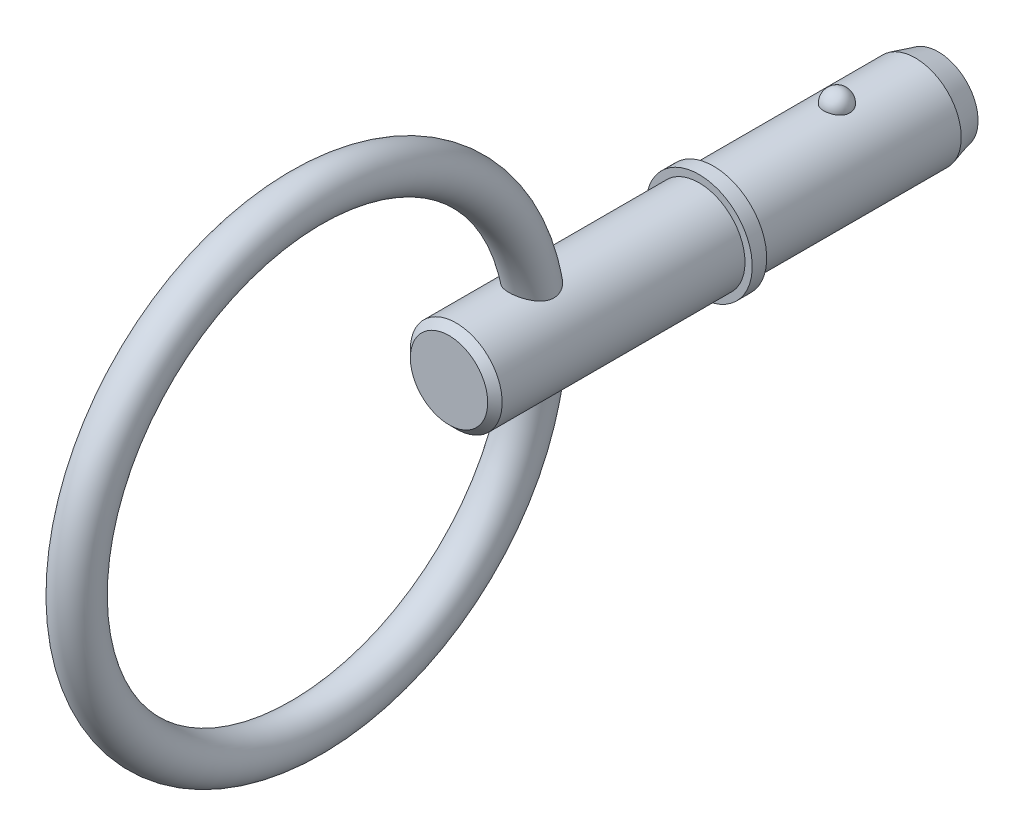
SolidWorks part; units mm, degrees
ref_plane "Front Plane" through (0, 0, 0) normal (0, 0, 1) x (1, 0, 0)
ref_plane "Top Plane" through (0, 0, 0) normal (0, 1, 0) x (1, 0, 0)
ref_plane "Right Plane" through (0, 0, 0) normal (1, 0, 0) x (0, 0, -1)
sketch "Sketch2" plane through (0, 0, 0) normal (0, 0, 1) x (1, 0, 0)
  circle A0 centre (0, 0) radius 3.175
  point P3 (0, 3.175)
  dimension "D1" = 6.35
extrude "Boss-Extrude1" add sketch "Sketch2" along normal blind 7.62
sketch "Sketch3" plane through (0, 0, 0) normal (0, 0, -1) x (-1, 0, 0)
  circle A0 centre (0, 0) radius 3.175
  dimension "D1" = 6.35
extrude "Boss-Extrude2" add sketch "Sketch3" along normal blind 7.92
chamfer "Chamfer1" distance 1.586 angle 15 1 edges at (-3.175, 0, -7.92)
sketch "Sketch18" plane through (0, 0, 0) normal (1, 0, 0) x (0, 0, -1)
  line L0 (6.334, 3.175) -> (-7.62, 3.175) construction
  line L1 (0.91, 4.085) -> (0.91, 2.265)
  line L2 (-7.62, -3.175) -> (6.334, -3.175) construction
  arc A0 (0.91, 4.085) -> (0.91, 2.265) centre (0.91, 3.175) ccw
  point P4 (0, 3.175)
  dimension "D1" = 7.26
revolve "Revolve1" add sketch "Sketch18" angle 360 about L1
sketch "Sketch19" plane through (0, 0, 0) normal (1, 0, 0) x (0, 0, -1)
  line L0 (-33.7288, 0) -> (-46.4542, 0) construction
sketch "Sketch20" plane through (0, 0, 0) normal (1, 0, 0) x (0, 0, -1)
  line L0 (-7.62, 0) -> (-7.62, 3.675)
  line L1 (-7.62, 3.175) -> (-7.62, -3.175) construction
  line L2 (-7.62, 3.675) -> (-8.62, 3.675)
  line L3 (-8.62, 3.675) -> (-8.62, 0)
  line L4 (-33.7288, 0) -> (-46.4542, 0) construction
  line L5 (-8.62, 0) -> (-7.62, 0)
  dimension "D1" = 3.675
  dimension "D2" = 1
revolve "Revolve2" add sketch "Sketch20" angle 360 about L0
sketch "Sketch21" plane through (0, 0, 7.62) normal (0, 0, -1) x (-1, 0, 0)
  circle A0 centre (0, 0) radius 3.175
  dimension "D1" = 6.35
extrude "Boss-Extrude3" add sketch "Sketch21" against normal blind 18.29
chamfer "Chamfer2" distance 0.5 angle 45 1 edges at (-3.175, 0, 25.91)
sketch "Sketch23" plane through (0, 0, 0) normal (1, 0, 0) x (0, 0, -1)
  line L0 (-25.91, 2.675) -> (-25.91, -2.675) construction
  circle A0 centre (-35.785, 0) radius 15.875
  point P2 (-19.91, 0)
  dimension "D1" = 31.75
  dimension "D2" = 6
sketch "Sketch24" plane through (0, 0, 0) normal (0, 1, 0) x (1, 0, 0)
  circle A0 centre (0, -19.91) radius 1.5
  dimension "D1" = 3
sweep "Sweep1" add profiles "Sketch24" path "Sketch23"
